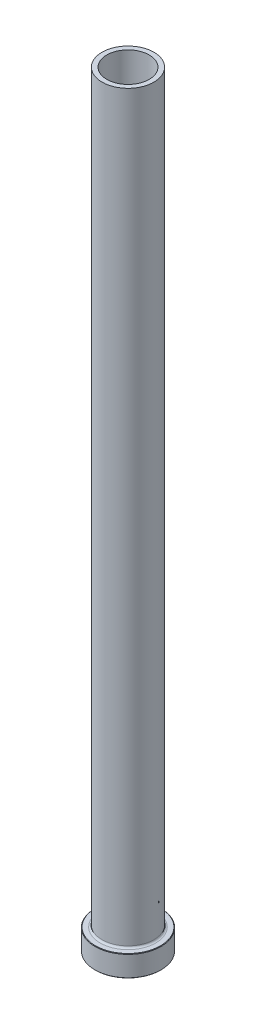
SolidWorks part; units mm, degrees
ref_plane "Front Plane" through (0, 0, 0) normal (0, 0, 1) x (1, 0, 0)
ref_plane "Top Plane" through (0, 0, 0) normal (0, 1, 0) x (1, 0, 0)
ref_plane "Right Plane" through (0, 0, 0) normal (1, 0, 0) x (0, 0, -1)
sketch "Sketch1" plane through (0, 0, 0) normal (0, 0, 1) x (1, 0, 0)
  line L0 (-9, 325) -> (-11, 325)
  line L1 (-11, 325) -> (-11, 9)
  line L2 (-11, 9) -> (-14, 9)
  line L3 (-14, 9) -> (-14, 0)
  line L4 (15.4, 0) -> (-15.4, 0) construction
  line L5 (-14, 0) -> (-9.25, 0)
  line L6 (-9, 270) -> (-9, 325)
  line L7 (0, 92.1877) -> (0, -15.5353) construction
  line L8 (0, -15.4) -> (0, 15.4) construction
  line L9 (-9, 270) -> (-9.25, 258)
  line L10 (-9.25, 258) -> (-9.25, 0)
  dimension "D1" = 0.25
  dimension "ID" = 18
  dimension "OD" = 22
  dimension "L" = 325
  dimension "H" = 28
  dimension "T" = 9
  dimension "N" = 55
  dimension "D2" = 12
revolve "Revolve1" add sketch "Sketch1" angle 360 about L7
fillet "Fillet1" radius 0.8 1 edges at (0, 9, 11)
chamfer "Chamfer1" distance 0.2 angle 45 2 edges at (0, 9, 14) (0, 0, 14)
chamfer "Chamfer3" distance 0.5 angle 45 1 edges at (0, 0, 9.25)
